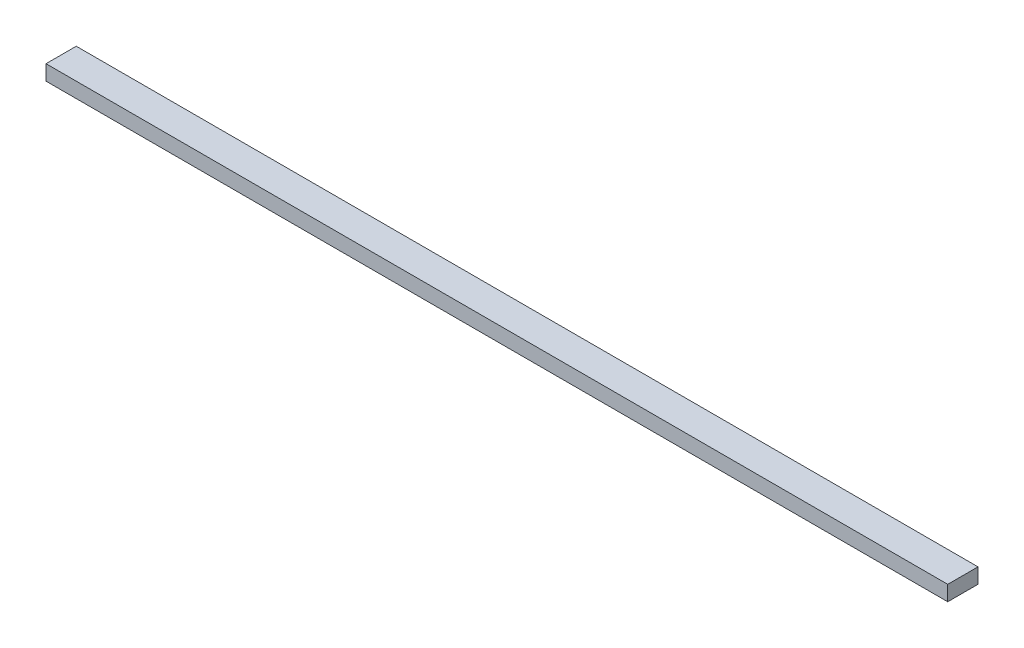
SolidWorks part; units mm, degrees
ref_plane "Face" through (0, 0, 0) normal (0, 0, 1) x (1, 0, 0)
ref_plane "Dessus" through (0, 0, 0) normal (0, 1, 0) x (1, 0, 0)
ref_plane "Droite" through (0, 0, 0) normal (1, 0, 0) x (0, 0, -1)
sketch "Esquisse1" plane through (0, 0, 0) normal (0, 1, 0) x (1, 0, 0)
  line L1 (0, 0) -> (298, 0)
  line L2 (0, 0) -> (0, 10)
  line L3 (0, 10) -> (298, 10)
  line L4 (298, 0) -> (298, 10)
  dimension "D1" = 298
  dimension "D2" = 10
extrude "Extrusion1" add sketch "Esquisse1" along normal blind 5
